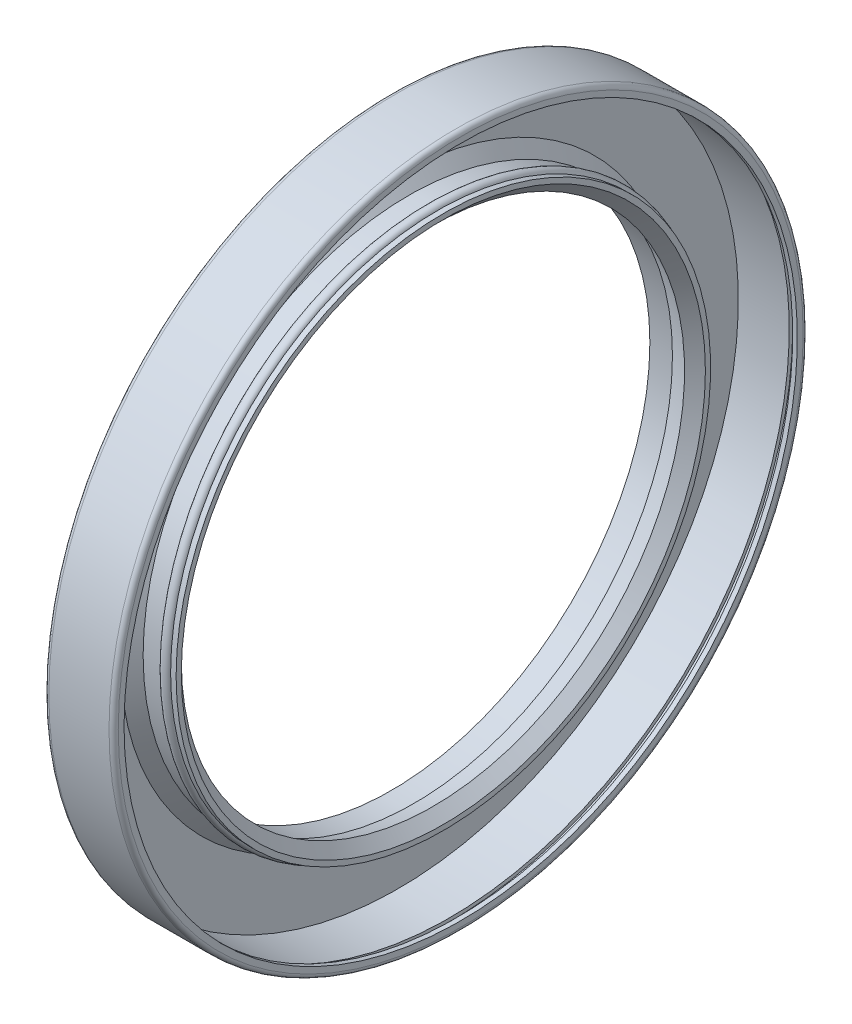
SolidWorks part; units mm, degrees
ref_plane "Plan1" through (0, 0, 0) normal (0, 0, 1) x (1, 0, 0)
ref_plane "Plan2" through (0, 0, 0) normal (0, 1, 0) x (1, 0, 0)
ref_plane "Plan3" through (0, 0, 0) normal (1, 0, 0) x (0, 0, -1)
sketch "Esquisse1" plane through (0, 0, 0) normal (0, 1, 0) x (1, 0, 0)
  line L0 (0, 0) -> (6.6667, 0) construction
  line L1 (0, 29.8) -> (0, 39.4667)
  line L2 (0.5333, 40) -> (7.4667, 40)
  line L3 (6.6667, 39.2) -> (6.6667, 39.6)
  line L4 (6.6667, 39.2) -> (0.8, 39.2)
  line L5 (0.8, 39.2) -> (0.8, 32.0301)
  line L6 (2.602, 29.8) -> (0, 29.8)
  line L9 (6.6667, 39.6) -> (7.4667, 39.6)
  line L11 (7.4667, 39.6) -> (7.4667, 38.8)
  line L12 (8, 38.8) -> (8, 39.4667)
  line L13 (7.4667, 38.8) -> (8, 38.8)
  line L14 (2.602, 29.8) -> (4.8, 29)
  line L15 (4.8, 29) -> (6, 30.2)
  line L16 (6, 30.2) -> (6, 30.8)
  line L17 (6, 30.8) -> (5.3657, 30.8)
  line L18 (0.8, 32.0301) -> (2, 30.6)
  line L22 (2, 30.6) -> (4.2, 30.6)
  arc A0 (0, 39.4667) -> (0.5333, 40) centre (0.5333, 39.4667) cw
  arc A1 (5.3657, 30.8) -> (4.2, 30.6) centre (4.8, 30.6) ccw
  arc A2 (7.4667, 40) -> (8, 39.4667) centre (7.4667, 39.4667) cw
  point P13 (0, 40)
  point P22 (8, 40)
  dimension "r" = 0.5333
  dimension "l" = 1.2
  dimension "D1" = 130
  dimension "De" = 40
  dimension "b" = 8
  dimension "e" = 0.8
  dimension "D7" = 45
  dimension "D6" = 20
  dimension "Di" = 29
  dimension "pl" = 6
  dimension "h" = 0.2
revolve "Base-Révolution" add sketch "Esquisse1" angle 360 about L0
sketch "Esquisse2" plane through (0, 0, 0) normal (-1, 0, 0) x (0, 0, 1)
  line L0 (0, 0) -> (29.8, 0) construction
  line L1 (29.8, 0) -> (30.2, 0) construction
  circle A0 centre (0, 0) radius 29.8 construction
  circle A2 centre (0, 0) radius 29.8 construction
  circle A3 centre (0, 0) radius 30.2
equation "\"e@Esquisse1\" = \"b@Esquisse1\"/10"
equation "\"i@Esquisse1\"=\"e@Esquisse1\"/2"
equation "\"r@Esquisse1\"=\"e@Esquisse1\"*2/3"
equation "\"l@Esquisse1\"=\"i@Esquisse1\"*3"
equation "\"pl@Esquisse1\"=\"b@Esquisse1\"*3/4"
equation "\"h@Esquisse1\"=\"i@Esquisse1\"/2"
